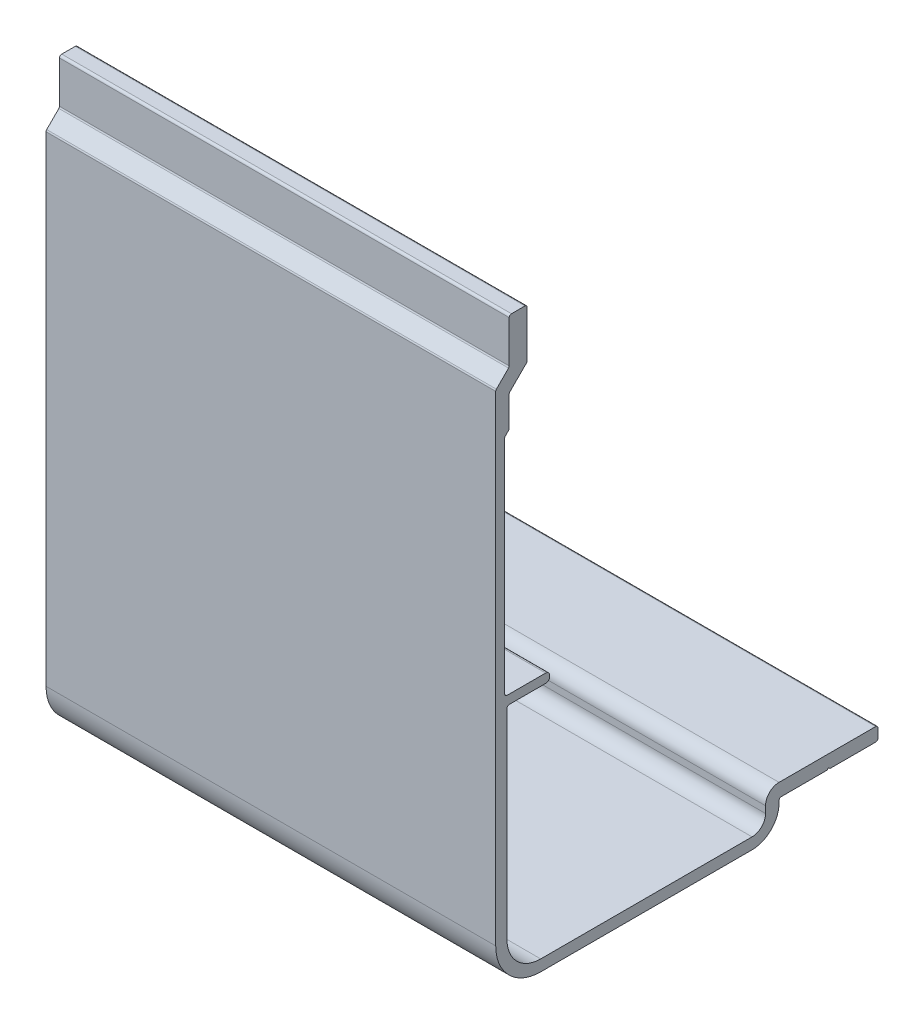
SolidWorks part; units mm, degrees
ref_plane "Front Plane" through (0, 0, 0) normal (0, 0, 1) x (1, 0, 0)
ref_plane "Top Plane" through (0, 0, 0) normal (0, 1, 0) x (1, 0, 0)
ref_plane "Right Plane" through (0, 0, 0) normal (1, 0, 0) x (0, 0, -1)
sketch "Sketch1" plane through (0, 0, 0) normal (1, 0, 0) x (0, 0, -1)
  line L0 (-2.8219, -9.7059) -> (44.1781, -9.7059)
  line L1 (50.1781, -3.7059) -> (50.1781, -3.2059)
  line L2 (60.8781, -2.7059) -> (50.6781, -2.7059)
  line L3 (72.1781, -2.2059) -> (72.1781, -0.2059)
  line L4 (71.6781, 0.2941) -> (50.1781, 0.2941)
  line L5 (47.1781, -2.7059) -> (47.1781, -4.2059)
  line L6 (44.1781, -7.2059) -> (-2.8219, -7.2059)
  line L7 (60.8781, -2.7059) -> (61.1781, -2.4059)
  line L8 (61.1781, -2.4059) -> (61.4781, -2.7059)
  line L9 (61.4781, -2.7059) -> (71.6781, -2.7059)
  line L10 (-10.3219, 0.2941) -> (-10.3219, 44.7941)
  line L11 (-9.8219, 45.2941) -> (-1.7219, 45.2941)
  line L12 (-0.8219, 46.1941) -> (-0.8219, 46.3941)
  line L13 (-1.7219, 47.2941) -> (-10.3219, 47.2941)
  line L14 (-12.8219, 107.087) -> (-12.8219, 0.2941)
  line L15 (-10.8219, 47.7941) -> (-10.8219, 97.087)
  line L16 (-12.6755, 107.4405) -> (-9.9684, 110.1476)
  line L17 (-9.8219, 110.5012) -> (-9.8219, 119.7941)
  line L18 (-9.3219, 120.2941) -> (-6.3219, 120.2941)
  line L19 (-5.8219, 119.7941) -> (-5.8219, 109.5012)
  line L20 (-5.9684, 109.1476) -> (-9.6755, 105.4405)
  line L21 (-9.8219, 105.087) -> (-9.8219, 98.5012)
  line L22 (-9.9684, 98.1476) -> (-10.6755, 97.4405)
  arc A0 (44.1781, -7.2059) -> (47.1781, -4.2059) centre (44.1781, -4.2059) ccw
  arc A1 (50.1781, 0.2941) -> (47.1781, -2.7059) centre (50.1781, -2.7059) ccw
  arc A2 (44.1781, -9.7059) -> (50.1781, -3.7059) centre (44.1781, -3.7059) ccw
  arc A3 (72.1781, -0.2059) -> (71.6781, 0.2941) centre (71.6781, -0.2059) ccw
  arc A4 (71.6781, -2.7059) -> (72.1781, -2.2059) centre (71.6781, -2.2059) ccw
  arc A5 (50.6781, -2.7059) -> (50.1781, -3.2059) centre (50.6781, -3.2059) ccw
  arc A6 (-10.3219, 0.2941) -> (-2.8219, -7.2059) centre (-2.8219, 0.2941) ccw
  arc A7 (-12.8219, 0.2941) -> (-2.8219, -9.7059) centre (-2.8219, 0.2941) ccw
  arc A8 (-10.8219, 47.7941) -> (-10.3219, 47.2941) centre (-10.3219, 47.7941) ccw
  arc A9 (-9.8219, 45.2941) -> (-10.3219, 44.7941) centre (-9.8219, 44.7941) ccw
  arc A10 (-0.8219, 46.3941) -> (-1.7219, 47.2941) centre (-1.7219, 46.3941) ccw
  arc A11 (-1.7219, 45.2941) -> (-0.8219, 46.1941) centre (-1.7219, 46.1941) ccw
  arc A12 (-10.6755, 97.4405) -> (-10.8219, 97.087) centre (-10.3219, 97.087) ccw
  arc A13 (-9.9684, 98.1476) -> (-9.8219, 98.5012) centre (-10.3219, 98.5012) ccw
  arc A14 (-9.6755, 105.4405) -> (-9.8219, 105.087) centre (-9.3219, 105.087) ccw
  arc A15 (-5.9684, 109.1476) -> (-5.8219, 109.5012) centre (-6.3219, 109.5012) ccw
  arc A16 (-9.9684, 110.1476) -> (-9.8219, 110.5012) centre (-10.3219, 110.5012) ccw
  arc A17 (-12.6755, 107.4405) -> (-12.8219, 107.087) centre (-12.3219, 107.087) ccw
  arc A18 (-9.3219, 120.2941) -> (-9.8219, 119.7941) centre (-9.3219, 119.7941) ccw
  arc A19 (-5.8219, 119.7941) -> (-6.3219, 120.2941) centre (-6.3219, 119.7941) ccw
extrude "Extrude1" add sketch "Sketch1" along normal mid plane 100
